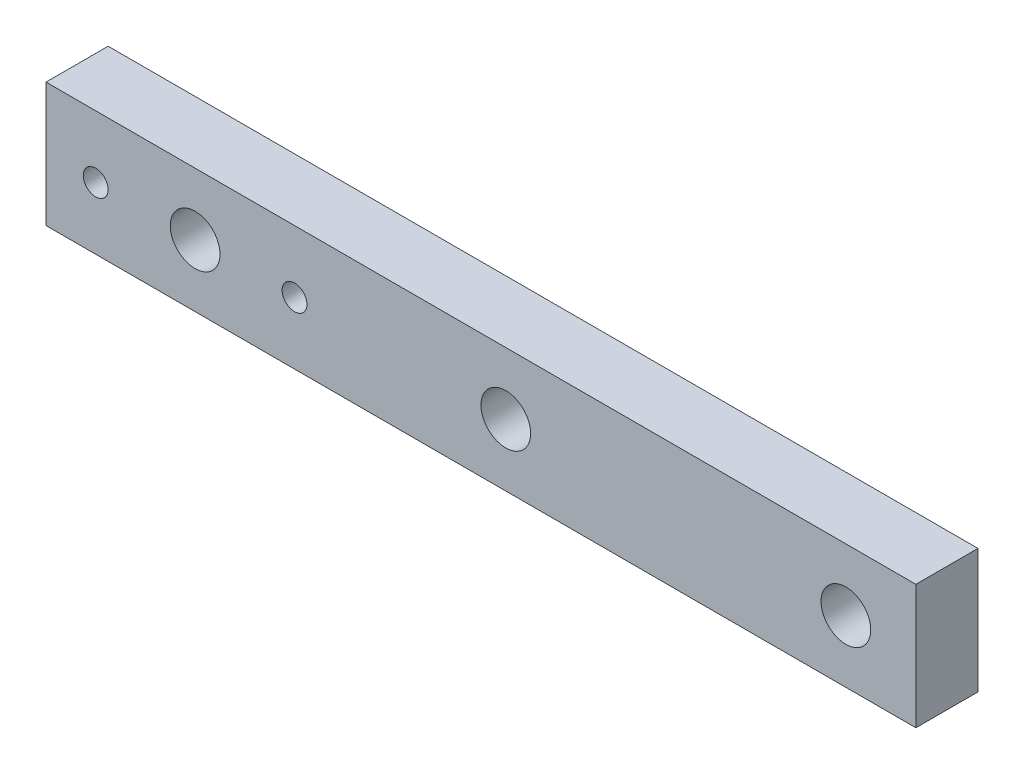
SolidWorks part; units mm, degrees
ref_plane "Front Plane" through (0, 0, 0) normal (0, 0, 1) x (1, 0, 0)
ref_plane "Top Plane" through (0, 0, 0) normal (0, 1, 0) x (1, 0, 0)
ref_plane "Right Plane" through (0, 0, 0) normal (1, 0, 0) x (0, 0, -1)
sketch "Sketch1" plane through (0, 0, 0) normal (0, 0, 1) x (1, 0, 0)
  line L1 (-33, 5) -> (37, 5)
  line L2 (-33, 5) -> (-33, -5)
  line L3 (-33, -5) -> (37, -5)
  line L4 (37, 5) -> (37, -5)
extrude "Boss-Extrude1" add sketch "Sketch1" along normal blind 5
sketch "Sketch2" plane through (0, 0, 5) normal (0, 0, 1) x (1, 0, 0)
  line L0 (-33, 5) -> (-33, -5) construction
  circle A0 centre (-29, 0) radius 1
  circle A1 centre (-21, 0) radius 2
  circle A2 centre (-13, 0) radius 1
  circle A3 centre (4, 0) radius 2
  circle A4 centre (31.367, 0) radius 2
  dimension "D1" = 4
  dimension "D2" = 8
  dimension "D3" = 8
  dimension "D4" = 25
  dimension "D5" = 27.367
extrude "Cut-Extrude1" cut sketch "Sketch2" against normal blind 5
sketch "Sketch3" plane through (0, 0, 5) normal (0, 0, 1) x (1, 0, 0)
  line L0 (-33, 0) -> (37, 0)
  line L1 (-33, 5) -> (-33, -5) construction
  line L2 (37, -5) -> (37, 5) construction
